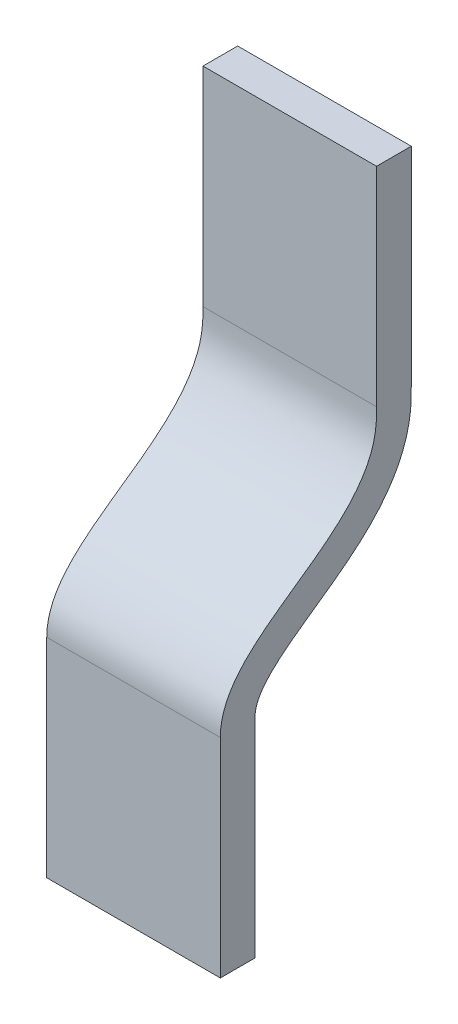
SolidWorks part; units mm, degrees
ref_plane "Front Plane" through (0, 0, 0) normal (0, 0, 1) x (1, 0, 0)
ref_plane "Top Plane" through (0, 0, 0) normal (0, 1, 0) x (1, 0, 0)
ref_plane "Right Plane" through (0, 0, 0) normal (1, 0, 0) x (0, 0, -1)
sketch "Sketch1" plane through (0, 0, 0) normal (1, 0, 0) x (0, 0, -1)
  line L0 (0, 0) -> (0, 60)
  line L1 (45, 120) -> (45, 180)
  spline S0 degree 3 poles (0, 60) (0, 83.75) (45, 90.0704) (45, 118.5748) (45, 120) knots 0 0 0 0 0.95 1 1 1 1
  dimension "D1" = 60
  dimension "D2" = 120
  dimension "D3" = 180
  dimension "D4" = 45
extrude "Extrude-Thin1" add sketch "Sketch1" along normal blind 50 thin
